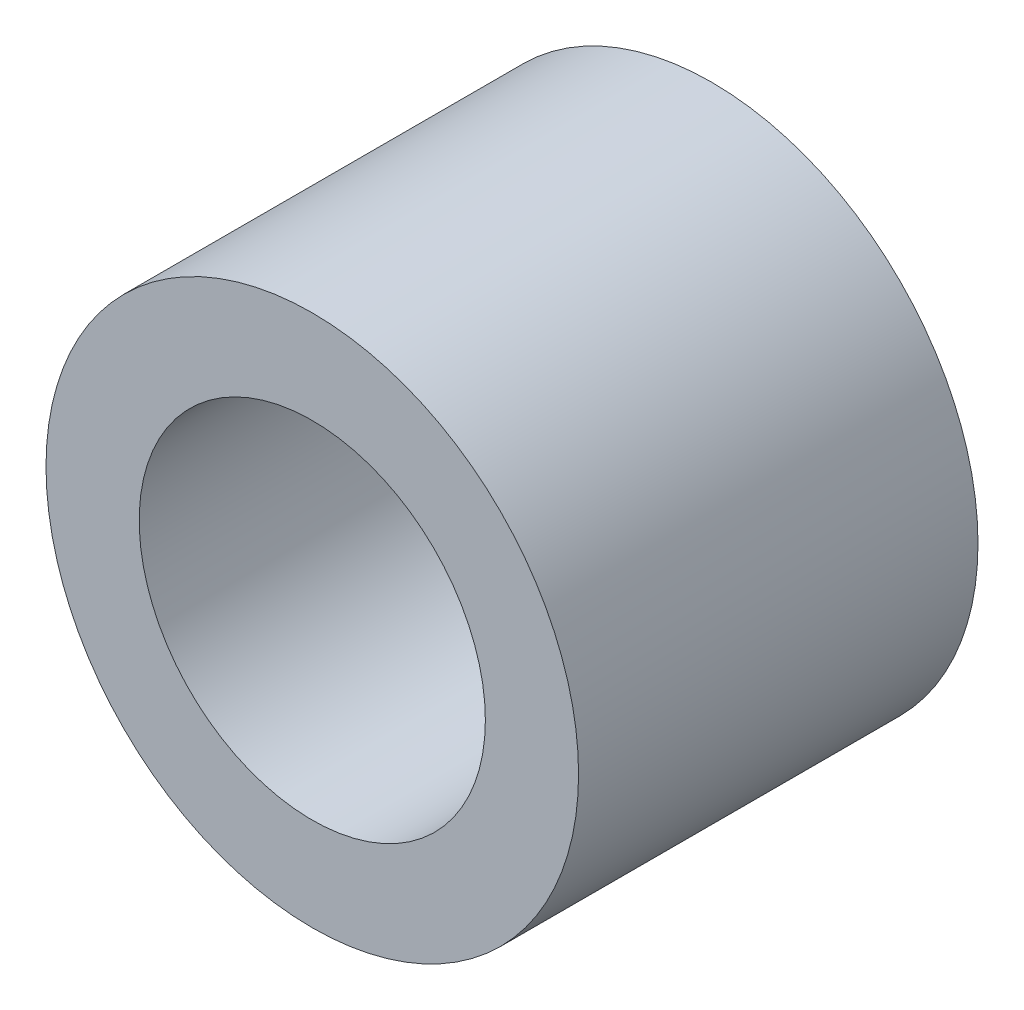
SolidWorks part; units mm, degrees
ref_plane "正面" through (0, 0, 0) normal (0, 0, 1) x (1, 0, 0)
ref_plane "平面" through (0, 0, 0) normal (0, 1, 0) x (1, 0, 0)
ref_plane "右側面" through (0, 0, 0) normal (1, 0, 0) x (0, 0, -1)
sketch "ｽｹｯﾁ2" plane through (0, 0, 0) normal (0, 0, 1) x (1, 0, 0)
  circle A0 centre (0, 0) radius 5
  dimension "D1" = 10
extrude "ﾎﾞｽ - 押し出し1" add sketch "ｽｹｯﾁ2" along normal blind 7.5
sketch "ｽｹｯﾁ3" plane through (0, 0, 7.5) normal (0, 0, 1) x (1, 0, 0)
  circle A0 centre (0, 0) radius 3.25
  dimension "D1" = 6.5
extrude "ｶｯﾄ - 押し出し1" cut sketch "ｽｹｯﾁ3" against normal blind 7.5
